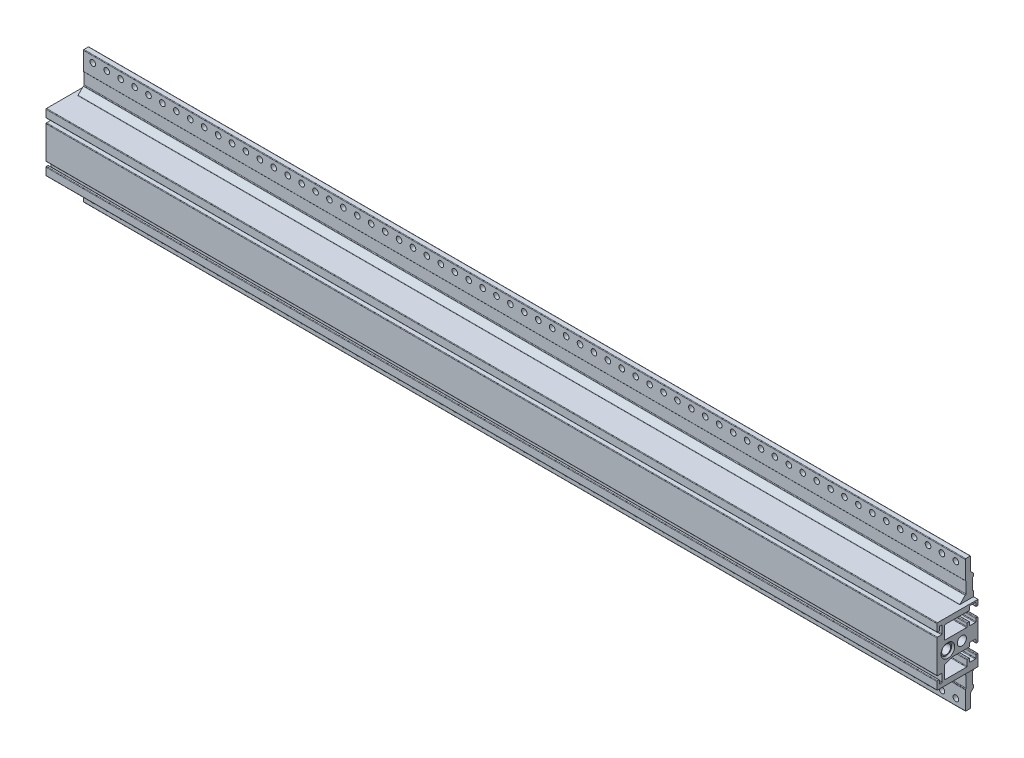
SolidWorks part; units mm, degrees
ref_plane "前视基准面" through (0, 0, 0) normal (0, 0, 1) x (1, 0, 0)
ref_plane "上视基准面" through (0, 0, 0) normal (0, 1, 0) x (1, 0, 0)
ref_plane "右视基准面" through (0, 0, 0) normal (1, 0, 0) x (0, 0, -1)
sketch "草图2" plane through (0, 0, 0) normal (1, 0, 0) x (0, 0, -1)
  line L0 (8.2, 24.1) -> (9.8, 24.1)
  line L1 (-3.8, 10.65) -> (5.9172, 10.65)
  line L2 (7.2, 5.2) -> (7.7, 5.2)
  line L3 (10.4, 5.2) -> (10.8, 5.2)
  line L4 (-1, 3.8) -> (6.8, 3.8)
  line L5 (8.1, 3.8) -> (10, 3.8)
  line L6 (8.1, 10.1) -> (10, 10.1)
  line L7 (-1, 8.7) -> (7.7, 8.7)
  line L8 (10.4, 8.7) -> (10.8, 8.7)
  line L9 (-3.8, 7.65) -> (-3.3, 7.65)
  line L10 (-2.9, 9.15) -> (-2.3, 9.15)
  line L11 (-3.8, 6.1) -> (-2.3, 6.1)
  line L12 (11, 18.0172) -> (11, 17.3)
  line L13 (11, 12.4627) -> (11, 8.9)
  line L14 (10.2, 9.9) -> (10.2, 8.9)
  line L15 (11, 5) -> (11, 1.325)
  line L16 (11, 1.025) -> (11, 0.15)
  line L17 (10.2, 9) -> (10.2, 8.9)
  line L18 (10.2, 5) -> (10.2, 4)
  line L19 (11, 0.15) -> (11, -2.65)
  line L20 (11, -6.55) -> (11, -12.45)
  line L21 (10.2, -1.65) -> (10.2, -2.65)
  line L22 (10.2, -6.55) -> (10.2, -7.55)
  line L23 (7, -6.55) -> (7, -8.5)
  line L24 (7.9, 9.9) -> (7.9, 8.9)
  line L25 (7.9, 5) -> (7.9, 4)
  line L26 (7.9, -1.65) -> (7.9, -2.65)
  line L27 (7.9, -6.55) -> (7.9, -7.55)
  line L28 (-1.2, 8.5) -> (-1.2, 4)
  line L29 (-1.2, -3.9892) -> (-1.2, -8.5)
  line L30 (11, -17.2873) -> (11, -18.0586)
  line L31 (10.7, 16.9127) -> (10.7, 12.85)
  line L32 (10.7, -12.8373) -> (10.7, -16.9)
  line L33 (10, 23.9) -> (10, 19.1828)
  line L34 (10, -19.1828) -> (10, -23.9)
  line L35 (8, 23.9) -> (8, 17.2873)
  line L36 (7, 5) -> (7, 4)
  line L38 (8.3, 16.9) -> (8.3, 12.85)
  line L39 (8.3, -12.85) -> (8.3, -16.9)
  line L40 (9.8, -24.1) -> (8.2, -24.1)
  line L41 (5.9172, -10.65) -> (-3.8, -10.65)
  line L42 (6.8, -8.7) -> (-1, -8.7)
  line L43 (10.7, -2.85) -> (10.5, -2.85)
  line L44 (11, 1.025) -> (10.85, 1.175)
  line L45 (11, 1.325) -> (10.85, 1.175)
  line L46 (10.8, -6.35) -> (10.4, -6.35)
  line L47 (7.7, -6.35) -> (7.2, -6.35)
  line L48 (10.8, -2.85) -> (10.4, -2.85)
  line L49 (7.7, -2.85) -> (1.5358, -2.85)
  line L50 (10, -1.45) -> (8.1, -1.45)
  line L51 (10, -7.75) -> (8.1, -7.75)
  line L52 (-3.3, -7.65) -> (-3.8, -7.65)
  line L53 (-2.3, -9.15) -> (-2.9, -9.15)
  line L54 (-2.3, -6.1) -> (-3.8, -6.1)
  line L55 (-4, -10.45) -> (-4, -7.85)
  line L56 (-4, -5.9) -> (-4, 5.9)
  line L57 (-4, 7.85) -> (-4, 10.45)
  line L58 (-3.1, -8.95) -> (-3.1, -7.85)
  line L59 (-3.1, 7.85) -> (-3.1, 8.95)
  line L60 (-2.1, -8.95) -> (-2.1, -6.3)
  line L61 (-2.1, 6.3) -> (-2.1, 8.95)
  line L62 (10.0586, -19.0414) -> (10.9707, -18.1293)
  line L63 (10.0586, 19.0414) -> (10.9414, 18.1586)
  line L64 (6.0586, 10.7086) -> (7.9418, 12.5918)
  line L65 (-1.0695, -3.8017) -> (1.4664, -2.8625)
  line L66 (8, -17.2873) -> (8, -23.9)
  line L68 (6.0586, -10.7086) -> (7.9418, -12.5918)
  arc A0 (8.3, 16.9) -> (8.15, 17.0936) centre (8.1, 16.9) ccw
  arc A1 (8, 17.2873) -> (8.15, 17.0936) centre (8.2, 17.2873) ccw
  arc A2 (10.85, 17.1064) -> (11, 17.3) centre (10.8, 17.3) ccw
  arc A3 (10.85, 17.1064) -> (10.7, 16.9127) centre (10.9, 16.9127) ccw
  arc A4 (5.9172, 10.65) -> (6.0586, 10.7086) centre (5.9172, 10.85) ccw
  arc A5 (-3.8, 10.65) -> (-4, 10.45) centre (-3.8, 10.45) ccw
  arc A6 (7.2, 5.2) -> (7, 5) centre (7.2, 5) ccw
  arc A7 (10.4, 5.2) -> (10.2, 5) centre (10.4, 5) ccw
  arc A8 (-1.2, 4) -> (-1, 3.8) centre (-1, 4) ccw
  arc A9 (10, 3.8) -> (10.2, 4) centre (10, 4) ccw
  arc A10 (7.9, 4) -> (8.1, 3.8) centre (8.1, 4) ccw
  arc A11 (10.2, 9.9) -> (10, 10.1) centre (10, 9.9) ccw
  arc A12 (7.7, 8.7) -> (7.9, 8.9) centre (7.7, 8.9) ccw
  arc A13 (-1, 8.7) -> (-1.2, 8.5) centre (-1, 8.5) ccw
  arc A14 (-3.3, 7.65) -> (-3.1, 7.85) centre (-3.3, 7.85) ccw
  arc A15 (-2.9, 9.15) -> (-3.1, 8.95) centre (-2.9, 8.95) ccw
  arc A16 (-2.3, 6.1) -> (-2.1, 6.3) centre (-2.3, 6.3) ccw
  arc A17 (8.0916, 12.6502) -> (8.3, 12.85) centre (8.1, 12.85) ccw
  arc A18 (8.0916, 12.6502) -> (7.9418, 12.5918) centre (8.0832, 12.4504) ccw
  arc A19 (10.7, 12.85) -> (10.85, 12.6564) centre (10.9, 12.85) ccw
  arc A20 (11, 12.4627) -> (10.85, 12.6564) centre (10.8, 12.4627) ccw
  arc A21 (11, 18.0172) -> (10.9414, 18.1586) centre (10.8, 18.0172) ccw
  arc A22 (10.8, 8.7) -> (11, 8.9) centre (10.8, 8.9) ccw
  arc A23 (11, 5) -> (10.8, 5.2) centre (10.8, 5) ccw
  arc A24 (10.2, 8.9) -> (10.4, 8.7) centre (10.4, 8.9) ccw
  arc A25 (10.2, -2.65) -> (10.4, -2.85) centre (10.4, -2.65) ccw
  arc A26 (10.4, -6.35) -> (10.2, -6.55) centre (10.4, -6.55) ccw
  arc A27 (7.2, -6.35) -> (7, -6.55) centre (7.2, -6.55) ccw
  arc A28 (6.8, -8.7) -> (7, -8.5) centre (6.8, -8.5) ccw
  arc A29 (8.1, 10.1) -> (7.9, 9.9) centre (8.1, 9.9) ccw
  arc A30 (7.9, 5) -> (7.7, 5.2) centre (7.7, 5) ccw
  arc A31 (8.1, -1.45) -> (7.9, -1.65) centre (8.1, -1.65) ccw
  arc A32 (7.9, -6.55) -> (7.7, -6.35) centre (7.7, -6.55) ccw
  arc A33 (7.9, -7.55) -> (8.1, -7.75) centre (8.1, -7.55) ccw
  arc A34 (-1.0695, -3.8017) -> (-1.2, -3.9892) centre (-1, -3.9892) ccw
  arc A35 (10, 23.9) -> (9.8, 24.1) centre (9.8, 23.9) ccw
  arc A36 (9.8, -24.1) -> (10, -23.9) centre (9.8, -23.9) ccw
  arc A37 (10.0586, -19.0414) -> (10, -19.1828) centre (10.2, -19.1828) ccw
  arc A38 (8.2, 24.1) -> (8, 23.9) centre (8.2, 23.9) ccw
  arc A39 (6.8, 3.8) -> (7, 4) centre (6.8, 4) ccw
  arc A40 (8, -23.9) -> (8.2, -24.1) centre (8.2, -23.9) ccw
  arc A41 (10.7, -16.9) -> (10.85, -17.0936) centre (10.9, -16.9) ccw
  arc A42 (11, -17.2873) -> (10.85, -17.0936) centre (10.8, -17.2873) ccw
  arc A43 (8.15, -17.0936) -> (8.3, -16.9) centre (8.1, -16.9) ccw
  arc A44 (8.15, -17.0936) -> (8, -17.2873) centre (8.2, -17.2873) ccw
  arc A45 (-4, -10.45) -> (-3.8, -10.65) centre (-3.8, -10.45) ccw
  arc A46 (-1.2, -8.5) -> (-1, -8.7) centre (-1, -8.5) ccw
  arc A47 (11, -6.55) -> (10.8, -6.35) centre (10.8, -6.55) ccw
  arc A48 (10.8, -2.85) -> (11, -2.65) centre (10.8, -2.65) ccw
  arc A49 (7.7, -2.85) -> (7.9, -2.65) centre (7.7, -2.65) ccw
  arc A50 (10.2, -1.65) -> (10, -1.45) centre (10, -1.65) ccw
  arc A51 (10, -7.75) -> (10.2, -7.55) centre (10, -7.55) ccw
  arc A52 (-3.1, -7.85) -> (-3.3, -7.65) centre (-3.3, -7.85) ccw
  arc A53 (-2.3, -9.15) -> (-2.1, -8.95) centre (-2.3, -8.95) ccw
  arc A54 (-2.1, -6.3) -> (-2.3, -6.1) centre (-2.3, -6.3) ccw
  arc A55 (10.85, -12.6436) -> (11, -12.45) centre (10.8, -12.45) ccw
  arc A56 (10.85, -12.6436) -> (10.7, -12.8373) centre (10.9, -12.8373) ccw
  arc A57 (-3.8, -7.65) -> (-4, -7.85) centre (-3.8, -7.85) ccw
  arc A58 (-4, -5.9) -> (-3.8, -6.1) centre (-3.8, -5.9) ccw
  arc A59 (-3.8, 6.1) -> (-4, 5.9) centre (-3.8, 5.9) ccw
  arc A60 (-4, 7.85) -> (-3.8, 7.65) centre (-3.8, 7.85) ccw
  arc A61 (-3.1, -8.95) -> (-2.9, -9.15) centre (-2.9, -8.95) ccw
  arc A62 (-2.1, 8.95) -> (-2.3, 9.15) centre (-2.3, 8.95) ccw
  arc A63 (10.9707, -18.1293) -> (11, -18.0586) centre (10.9, -18.0586) ccw
  arc A64 (10, 19.1828) -> (10.0586, 19.0414) centre (10.2, 19.1828) ccw
  arc A65 (1.5358, -2.85) -> (1.4664, -2.8625) centre (1.5358, -3.05) ccw
  circle A66 centre (0, 0) radius 1.6
  arc A70 (5.9172, -10.65) -> (6.0586, -10.7086) centre (5.9172, -10.85) cw
  arc A71 (8.0916, -12.6502) -> (7.9418, -12.5918) centre (8.0832, -12.4504) cw
  arc A72 (8.0916, -12.6502) -> (8.3, -12.85) centre (8.1, -12.85) cw
extrude "凸台-拉伸1" add sketch "草图2" along normal mid plane 431.8
sketch "草图3" plane through (0, 0, 4) normal (0, 0, 1) x (1, 0, 0)
  line L0 (215.9, -10.65) -> (-215.9, -10.65) construction
  line L1 (215.9, -24.1) -> (214.25, -24.1)
  line L2 (215.9, -24.1) -> (215.9, -10.65)
  line L3 (215.9, -10.65) -> (214.25, -10.65)
  line L4 (214.25, -24.1) -> (214.25, -10.65)
  line L6 (0, 0) -> (0, -44.0064) construction
  line L8 (215.9, 24.1) -> (214.25, 24.1)
  line L9 (215.9, 24.1) -> (215.9, 10.65)
  line L10 (215.9, 10.65) -> (214.25, 10.65)
  line L11 (214.25, 24.1) -> (214.25, 10.65)
  line L12 (215.9, 10.65) -> (-215.9, 10.65) construction
  line L13 (-214.25, 24.1) -> (-214.25, 10.65)
  line L14 (-215.9, 10.65) -> (-214.25, 10.65)
  line L15 (-215.9, 24.1) -> (-215.9, 10.65)
  line L16 (-215.9, 24.1) -> (-214.25, 24.1)
  line L17 (-214.25, -24.1) -> (-214.25, -10.65)
  line L18 (-215.9, -10.65) -> (-214.25, -10.65)
  line L19 (-215.9, -24.1) -> (-215.9, -10.65)
  line L20 (-215.9, -24.1) -> (-214.25, -24.1)
  dimension "D1" = 1.65
extrude "切除-拉伸1" cut sketch "草图3" against normal through all
sketch "草图4" plane through (0, 0, -10) normal (0, 0, -1) x (-1, 0, 0)
  line L0 (-215.9, 10.65) -> (-215.9, 8.9) construction
  line L2 (-214.25, 24.1) -> (-234.25, 24.1) construction
  line L3 (-214.25, -24.1) -> (-234.25, -24.1) construction
  line L4 (-224.25, 24.1) -> (-224.25, -24.1) construction
  line L5 (-224.25, 0) -> (-201.0943, 0) construction
  circle A0 centre (-210.82, 21.65) radius 0.75
  circle A1 centre (-210.82, -21.65) radius 0.75
  circle A2 centre (-205.74, 21.65) radius 0.75
  circle A3 centre (-205.74, -21.65) radius 0.75
  circle A4 centre (-200.66, 21.65) radius 0.75
  circle A5 centre (-200.66, -21.65) radius 0.75
  circle A6 centre (-195.58, 21.65) radius 0.75
  circle A7 centre (-195.58, -21.65) radius 0.75
  circle A8 centre (-190.5, 21.65) radius 0.75
  circle A9 centre (-190.5, -21.65) radius 0.75
  circle A10 centre (-185.42, 21.65) radius 0.75
  circle A11 centre (-185.42, -21.65) radius 0.75
  circle A12 centre (-180.34, 21.65) radius 0.75
  circle A13 centre (-180.34, -21.65) radius 0.75
  circle A14 centre (-175.26, 21.65) radius 0.75
  circle A15 centre (-175.26, -21.65) radius 0.75
  circle A16 centre (-170.18, 21.65) radius 0.75
  circle A17 centre (-170.18, -21.65) radius 0.75
  circle A18 centre (-165.1, 21.65) radius 0.75
  circle A19 centre (-165.1, -21.65) radius 0.75
  circle A20 centre (-160.02, 21.65) radius 0.75
  circle A21 centre (-160.02, -21.65) radius 0.75
  circle A22 centre (-154.94, 21.65) radius 0.75
  circle A23 centre (-154.94, -21.65) radius 0.75
  circle A24 centre (-149.86, 21.65) radius 0.75
  circle A25 centre (-149.86, -21.65) radius 0.75
  circle A26 centre (-144.78, 21.65) radius 0.75
  circle A27 centre (-144.78, -21.65) radius 0.75
  circle A28 centre (-139.7, 21.65) radius 0.75
  circle A29 centre (-139.7, -21.65) radius 0.75
  circle A30 centre (-134.62, 21.65) radius 0.75
  circle A31 centre (-134.62, -21.65) radius 0.75
  circle A32 centre (-129.54, 21.65) radius 0.75
  circle A33 centre (-129.54, -21.65) radius 0.75
  circle A34 centre (-124.46, 21.65) radius 0.75
  circle A35 centre (-124.46, -21.65) radius 0.75
  circle A36 centre (-119.38, 21.65) radius 0.75
  circle A37 centre (-119.38, -21.65) radius 0.75
  circle A38 centre (-114.3, 21.65) radius 0.75
  circle A39 centre (-114.3, -21.65) radius 0.75
  circle A40 centre (-109.22, 21.65) radius 0.75
  circle A41 centre (-109.22, -21.65) radius 0.75
  circle A42 centre (-104.14, 21.65) radius 0.75
  circle A43 centre (-104.14, -21.65) radius 0.75
  circle A44 centre (-99.06, 21.65) radius 0.75
  circle A45 centre (-99.06, -21.65) radius 0.75
  circle A46 centre (-93.98, 21.65) radius 0.75
  circle A47 centre (-93.98, -21.65) radius 0.75
  circle A48 centre (-88.9, 21.65) radius 0.75
  circle A49 centre (-88.9, -21.65) radius 0.75
  circle A50 centre (-83.82, 21.65) radius 0.75
  circle A51 centre (-83.82, -21.65) radius 0.75
  circle A52 centre (-78.74, 21.65) radius 0.75
  circle A53 centre (-78.74, -21.65) radius 0.75
  circle A54 centre (-73.66, 21.65) radius 0.75
  circle A55 centre (-73.66, -21.65) radius 0.75
  circle A56 centre (-68.58, 21.65) radius 0.75
  circle A57 centre (-68.58, -21.65) radius 0.75
  circle A58 centre (-63.5, 21.65) radius 0.75
  circle A59 centre (-63.5, -21.65) radius 0.75
  circle A60 centre (-58.42, 21.65) radius 0.75
  circle A61 centre (-58.42, -21.65) radius 0.75
  circle A62 centre (-53.34, 21.65) radius 0.75
  circle A63 centre (-53.34, -21.65) radius 0.75
  circle A64 centre (-48.26, 21.65) radius 0.75
  circle A65 centre (-48.26, -21.65) radius 0.75
  circle A66 centre (-43.18, 21.65) radius 0.75
  circle A67 centre (-43.18, -21.65) radius 0.75
  circle A68 centre (-38.1, 21.65) radius 0.75
  circle A69 centre (-38.1, -21.65) radius 0.75
  circle A70 centre (-33.02, 21.65) radius 0.75
  circle A71 centre (-33.02, -21.65) radius 0.75
  circle A72 centre (-27.94, 21.65) radius 0.75
  circle A73 centre (-27.94, -21.65) radius 0.75
  circle A74 centre (-22.86, 21.65) radius 0.75
  circle A75 centre (-22.86, -21.65) radius 0.75
  circle A76 centre (-17.78, 21.65) radius 0.75
  circle A77 centre (-17.78, -21.65) radius 0.75
  circle A78 centre (-12.7, 21.65) radius 0.75
  circle A79 centre (-12.7, -21.65) radius 0.75
  circle A80 centre (-7.62, 21.65) radius 0.75
  circle A81 centre (-7.62, -21.65) radius 0.75
  circle A82 centre (-2.54, 21.65) radius 0.75
  circle A83 centre (-2.54, -21.65) radius 0.75
  circle A84 centre (2.54, 21.65) radius 0.75
  circle A85 centre (2.54, -21.65) radius 0.75
  circle A86 centre (7.62, 21.65) radius 0.75
  circle A87 centre (7.62, -21.65) radius 0.75
  circle A88 centre (12.7, 21.65) radius 0.75
  circle A89 centre (12.7, -21.65) radius 0.75
  circle A90 centre (17.78, 21.65) radius 0.75
  circle A91 centre (17.78, -21.65) radius 0.75
  circle A92 centre (22.86, 21.65) radius 0.75
  circle A93 centre (22.86, -21.65) radius 0.75
  circle A94 centre (27.94, 21.65) radius 0.75
  circle A95 centre (27.94, -21.65) radius 0.75
  circle A96 centre (33.02, 21.65) radius 0.75
  circle A97 centre (33.02, -21.65) radius 0.75
  circle A98 centre (38.1, 21.65) radius 0.75
  circle A99 centre (38.1, -21.65) radius 0.75
  circle A100 centre (43.18, 21.65) radius 0.75
  circle A101 centre (43.18, -21.65) radius 0.75
  circle A102 centre (48.26, 21.65) radius 0.75
  circle A103 centre (48.26, -21.65) radius 0.75
  circle A104 centre (53.34, 21.65) radius 0.75
  circle A105 centre (53.34, -21.65) radius 0.75
  circle A106 centre (58.42, 21.65) radius 0.75
  circle A107 centre (58.42, -21.65) radius 0.75
  circle A108 centre (63.5, 21.65) radius 0.75
  circle A109 centre (63.5, -21.65) radius 0.75
  circle A110 centre (68.58, 21.65) radius 0.75
  circle A111 centre (68.58, -21.65) radius 0.75
  circle A112 centre (73.66, 21.65) radius 0.75
  circle A113 centre (73.66, -21.65) radius 0.75
  circle A114 centre (78.74, 21.65) radius 0.75
  circle A115 centre (78.74, -21.65) radius 0.75
  circle A116 centre (83.82, 21.65) radius 0.75
  circle A117 centre (83.82, -21.65) radius 0.75
  circle A118 centre (88.9, 21.65) radius 0.75
  circle A119 centre (88.9, -21.65) radius 0.75
  circle A120 centre (93.98, 21.65) radius 0.75
  circle A121 centre (93.98, -21.65) radius 0.75
  circle A122 centre (99.06, 21.65) radius 0.75
  circle A123 centre (99.06, -21.65) radius 0.75
  circle A124 centre (104.14, 21.65) radius 0.75
  circle A125 centre (104.14, -21.65) radius 0.75
  circle A126 centre (109.22, 21.65) radius 0.75
  circle A127 centre (109.22, -21.65) radius 0.75
  circle A128 centre (114.3, 21.65) radius 0.75
  circle A129 centre (114.3, -21.65) radius 0.75
  circle A130 centre (119.38, 21.65) radius 0.75
  circle A131 centre (119.38, -21.65) radius 0.75
  circle A132 centre (124.46, 21.65) radius 0.75
  circle A133 centre (124.46, -21.65) radius 0.75
  circle A134 centre (129.54, 21.65) radius 0.75
  circle A135 centre (129.54, -21.65) radius 0.75
  circle A136 centre (134.62, 21.65) radius 0.75
  circle A137 centre (134.62, -21.65) radius 0.75
  circle A138 centre (139.7, 21.65) radius 0.75
  circle A139 centre (139.7, -21.65) radius 0.75
  circle A140 centre (144.78, 21.65) radius 0.75
  circle A141 centre (144.78, -21.65) radius 0.75
  circle A142 centre (149.86, 21.65) radius 0.75
  circle A143 centre (149.86, -21.65) radius 0.75
  circle A144 centre (154.94, 21.65) radius 0.75
  circle A145 centre (154.94, -21.65) radius 0.75
  circle A146 centre (160.02, 21.65) radius 0.75
  circle A147 centre (160.02, -21.65) radius 0.75
  circle A148 centre (165.1, 21.65) radius 0.75
  circle A149 centre (165.1, -21.65) radius 0.75
  circle A150 centre (170.18, 21.65) radius 0.75
  circle A151 centre (170.18, -21.65) radius 0.75
  circle A152 centre (175.26, 21.65) radius 0.75
  circle A153 centre (175.26, -21.65) radius 0.75
  circle A154 centre (180.34, 21.65) radius 0.75
  circle A155 centre (180.34, -21.65) radius 0.75
  circle A156 centre (185.42, 21.65) radius 0.75
  circle A157 centre (185.42, -21.65) radius 0.75
  circle A158 centre (190.5, 21.65) radius 0.75
  circle A159 centre (190.5, -21.65) radius 0.75
  circle A160 centre (195.58, 21.65) radius 0.75
  circle A161 centre (195.58, -21.65) radius 0.75
  circle A162 centre (200.66, 21.65) radius 0.75
  circle A163 centre (200.66, -21.65) radius 0.75
  circle A164 centre (205.74, 21.65) radius 0.75
  circle A165 centre (205.74, -21.65) radius 0.75
  circle A166 centre (210.82, 21.65) radius 0.75
  circle A167 centre (210.82, -21.65) radius 0.75
  dimension "D1" = 1.5
  dimension "D2" = 5.08
  dimension "D3" = 20
  dimension "D4" = 43.3
  dimension "D6" = 5.08
  dimension "D5" = 84
extrude "切除-拉伸2" cut sketch "草图4" against normal through all
hole_wizard "M2.5 螺纹孔1" positions "3D草图1" profile "草图5" tap size "M2.5" standard "Gb"
sketch3d "3D草图1"
  line L0 (210.82, 21.65, -8) -> (210.82, 21.65, -10) construction
  line L1 (210.82, -21.65, -8) -> (210.82, -21.65, -10) construction
  point P0 (210.82, 21.65, -10)
  point P4 (210.82, -21.65, -10)
sketch "草图5" plane through (210.82, 21.65, -10) normal (1, 0, 0) x (0, 1, 0)
  line L0 (0, 0) -> (0, 14)
  line L1 (0, 14) -> (1.025, 14)
  line L2 (1.025, 14) -> (1.025, 0)
  line L5 (1.025, 0) -> (0, 0)
  line L11 (0, -6.35) -> (0, 107.95) construction
  dimension "通孔螺纹孔钻头直径" = 2.05
  dimension "通孔螺纹孔钻头深度" = 14
pattern_linear "阵列(线性)1" count 84 spacing 5.08 along (-1, 0, 0) of "M2.5 螺纹孔1"
hole_wizard "M4 螺纹孔1" positions "3D草图2" profile "草图6" tap size "M4" standard "Gb"
sketch3d "3D草图2"
  line L0 (215.9, 0, 0) -> (-215.9, 0, 0) construction
  point P0 (0, 0, 0)
  point P4 (-215.9, 0, 0)
  point P8 (215.9, 0, 0)
sketch "草图6" plane through (-215.9, 0, 0) normal (0, 1, 0) x (0, 0, 1)
  line L0 (0, 0) -> (0, 15.0914)
  line L1 (0, 15.0914) -> (1.65, 14.1)
  line L2 (1.65, 14.1) -> (1.65, 0)
  line L5 (1.65, 0) -> (0, 0)
  line L10 (0, 15.0914) -> (-1.65, 14.1) construction
  line L11 (0, -6.35) -> (0, 107.95) construction
  dimension "螺纹孔钻头直径" = 3.3
  dimension "螺纹孔钻头深度" = 14.1
  dimension "导头角度" = 118
chamfer "倒角1" distance 0.6 angle 45 2 edges at (215.9, 0, -1.65) (-215.9, 0, 1.65)
sketch "草图7" plane through (-215.9, 0, 0) normal (-1, 0, 0) x (0, 0, 1)
  circle A0 centre (-5.1, 0.5) radius 1.65
  circle A1 centre (0, 0) radius 1.65 construction
  circle A2 centre (0, 0) radius 2.25 construction
  dimension "D1" = 5.1
  dimension "D2" = 0.5
  dimension "D3" = 3.3
extrude "切除-拉伸3" cut sketch "草图7" against normal blind 20
sketch "草图8" plane through (-214.25, 0, 0) normal (-1, 0, 0) x (0, 0, 1)
  line L0 (-5.8819, -10.65) -> (-8, -10.65)
  line L1 (-11, -10.65) -> (3.8, -10.65) construction
  line L2 (-11, -10.65) -> (-5.9172, -10.65) construction
  line L3 (-8, -10.65) -> (-8, -13.2407)
  line L4 (-8, -13.2407) -> (-5.8819, -10.65)
  line L5 (-11, -12.45) -> (-11, -10.65) construction
  dimension "D1" = 3
extrude "切除-拉伸4" cut sketch "草图8" against normal through all
fillet "圆角1" radius 0.2 2 edges at (0, -12.6322, -8) (0, -10.65, -8)
sketch "草图9" plane through (215.9, 0, 0) normal (1, 0, 0) x (0, 0, -1)
  circle A0 centre (5.1, 0.5) radius 1.65
  circle A1 centre (0, 0) radius 2.25 construction
  dimension "D1" = 3.3
  dimension "D2" = 5.1
  dimension "D3" = 0.5
extrude "切除-拉伸5" cut sketch "草图9" against normal blind 20
sketch "草图10" plane through (0, 0, 4) normal (0, 0, 1) x (1, 0, 0)
  line L0 (-215.9, -5.9) -> (-215.9, 5.9) construction
  line L1 (215.9, 39.2787) -> (109.22, 39.2787)
  line L2 (215.9, 39.2787) -> (215.9, -44.6046)
  line L3 (215.9, -44.6046) -> (109.22, -44.6046)
  line L4 (109.22, 39.2787) -> (109.22, -44.6046)
  line L5 (215.9, -5.9) -> (215.9, 5.9) construction
  dimension "D1" = 325.12
extrude "切除-拉伸6" cut sketch "草图10" against normal blind 23
sketch "草图12" plane through (0, 0, 4) normal (0, 0, 1) x (1, 0, 0)
  line L1 (109.22, 24.1) -> (107.57, 24.1)
  line L2 (109.22, 24.1) -> (109.22, 10.65)
  line L3 (109.22, 10.65) -> (107.57, 10.65)
  line L4 (107.57, 24.1) -> (107.57, 10.65)
  line L5 (109.22, -24.1) -> (107.57, -24.1)
  line L6 (109.22, -24.1) -> (109.22, -10.65)
  line L7 (109.22, -10.65) -> (107.57, -10.65)
  line L8 (107.57, -24.1) -> (107.57, -10.65)
  dimension "D1" = 1.65
  dimension "D2" = 13.45
  dimension "D3" = 1.65
  dimension "D4" = 13.45
extrude "切除-拉伸7" cut sketch "草图12" against normal blind 23
hole_wizard "M4 螺纹孔3" positions "草图18" profile "草图17" tap size "M4" standard "GB"
sketch "草图18" plane through (109.22, 0, 0) normal (1, 0, 0) x (0, 0, -1)
  point P0 (0, 0)
sketch "草图17" plane through (109.22, 0, 0) normal (0, 1, 0) x (0, 0, -1)
  line L0 (0, 0) -> (0, 15.7914)
  line L1 (0, 15.7914) -> (1.65, 14.8)
  line L2 (1.65, 14.8) -> (1.65, 0)
  line L5 (1.65, 0) -> (0, 0)
  line L10 (0, 15.7914) -> (-1.65, 14.8) construction
  line L11 (0, -6.35) -> (0, 107.95) construction
  dimension "螺纹孔钻头直径" = 3.3
  dimension "螺纹孔钻头深度" = 14.8
  dimension "导头角度" = 118
sketch "草图20" plane through (109.22, 0, 0) normal (1, 0, 0) x (0, 0, -1)
  circle A0 centre (0, 0) radius 2
extrude "切除-拉伸8" cut sketch "草图20" against normal blind 0.6
chamfer "倒角3" distance 0.5 distance2 0.6 1 edges at (109.22, 2, 0)
sketch "草图21" plane through (109.22, 0, 0) normal (1, 0, 0) x (0, 0, -1)
  circle A0 centre (5.1, 0.5) radius 1.65
extrude "切除-拉伸9" cut sketch "草图21" against normal blind 20
